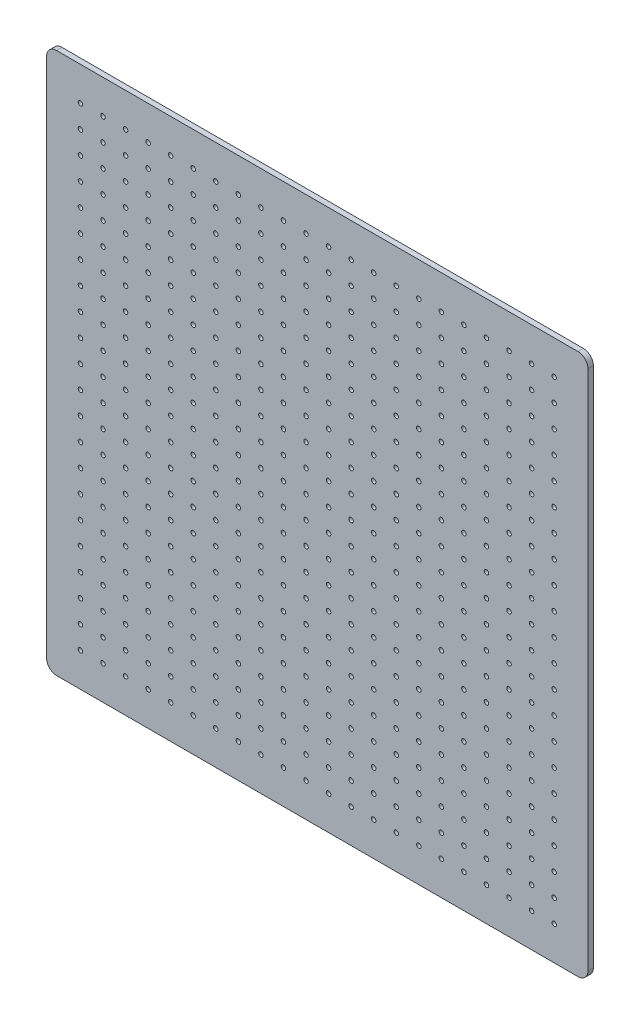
SolidWorks part; units mm, degrees
ref_plane "前视基准面" through (0, 0, 0) normal (0, 0, 1) x (1, 0, 0)
ref_plane "上视基准面" through (0, 0, 0) normal (0, 1, 0) x (1, 0, 0)
ref_plane "右视基准面" through (0, 0, 0) normal (1, 0, 0) x (0, 0, -1)
sketch "草图1" plane through (0, 0, 0) normal (0, 0, 1) x (1, 0, 0)
  line L1 (-289, -300) -> (289, -300)
  line L2 (-300, -289) -> (-300, 289)
  line L3 (-289, 300) -> (289, 300)
  line L4 (300, -289) -> (300, 289)
  line L5 (-300, -300) -> (300, 300) construction
  line L6 (-300, 300) -> (300, -300) construction
  arc A0 (289, -300) -> (300, -289) centre (289, -289) ccw
  arc A1 (289, 300) -> (300, 289) centre (289, 289) cw
  arc A2 (-289, -300) -> (-300, -289) centre (-289, -289) cw
  arc A3 (-300, 289) -> (-289, 300) centre (-289, 289) cw
  point P0 (0, 0)
  dimension "D3" = 11
  dimension "D1" = 600
  dimension "D2" = 600
extrude "凸台-拉伸1" add sketch "草图1" along normal blind 6
hole_wizard "M6 螺纹孔1" positions "3D草图1" profile "草图3" tap size "M6" standard "GB"
sketch3d "3D草图1"
  line L0 (289, 300, 6) -> (-289, 300, 6) construction
  line L1 (-300, 289, 6) -> (-300, -289, 6) construction
  point P0 (-262.5, 262.5, 6)
  dimension "D1" = 37.5
  dimension "D2" = 37.5
sketch "草图3" plane through (-262.5, 262.5, 6) normal (1, 0, 0) x (0, -1, 0)
  line L0 (0, 0) -> (0, 6)
  line L1 (0, 6) -> (2.5, 6)
  line L2 (2.5, 6) -> (2.5, 0)
  line L5 (2.5, 0) -> (0, 0)
  line L11 (0, -6.35) -> (0, 107.95) construction
  dimension "通孔螺纹孔钻头直径" = 5
  dimension "通孔螺纹孔钻头深度" = 6
pattern_linear "阵列(线性)1" count 22 spacing 25 along (1, 0, 0) count 22 spacing 25 along (0, -1, 0) of "M6 螺纹孔1"
